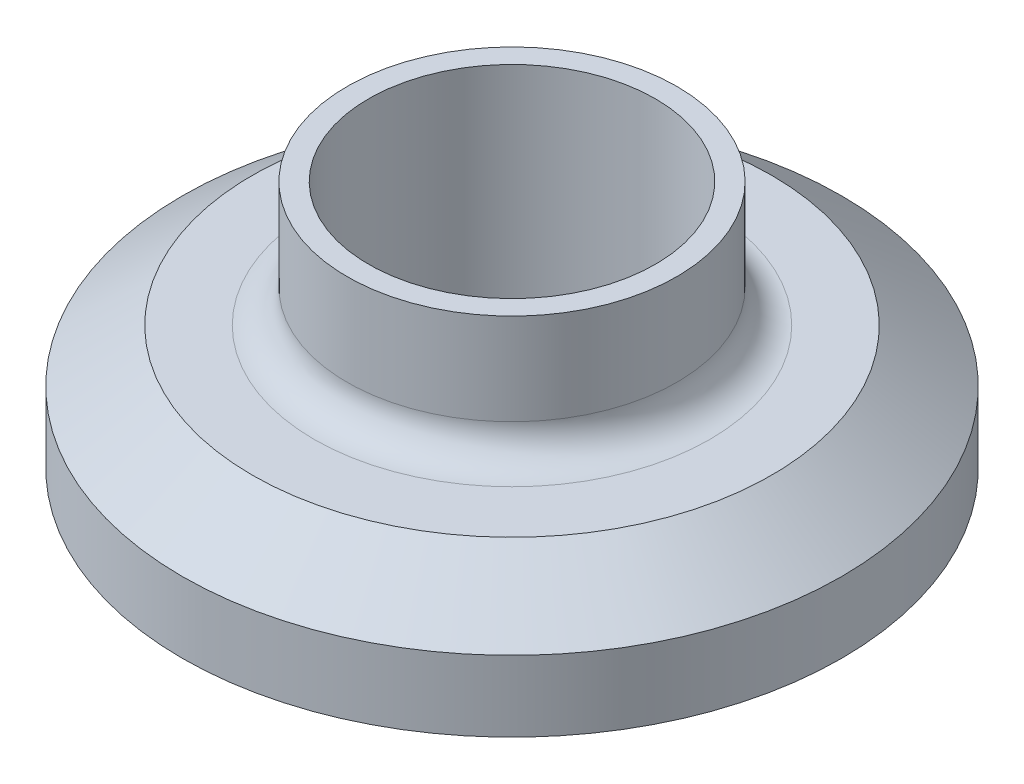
SolidWorks part; units mm, degrees
ref_plane "Front Plane" through (0, 0, 0) normal (0, 0, 1) x (1, 0, 0)
ref_plane "Top Plane" through (0, 0, 0) normal (0, 1, 0) x (1, 0, 0)
ref_plane "Right Plane" through (0, 0, 0) normal (1, 0, 0) x (0, 0, -1)
sketch "Sketch1" plane through (0, 0, 0) normal (0, 0, 1) x (1, 0, 0)
  line L0 (-19.6128, 0) -> (-25.4, 0)
  line L1 (-25.4, 0) -> (-25.4, 5.461)
  line L2 (-25.4, 5.461) -> (-20.0069, 9.525)
  line L3 (-12.7, 12.2874) -> (-12.7, 19.1139)
  line L4 (-12.7, 19.1139) -> (-11.049, 19.1139)
  line L5 (-11.049, 19.1139) -> (-11.049, 0)
  line L6 (-11.049, 0) -> (-16.5568, 0)
  line L7 (-12.7, 12.2874) -> (-12.7, 12.065)
  line L8 (-15.24, 9.525) -> (-20.0069, 9.525)
  line L9 (0, 0) -> (0, 37.2164) construction
  arc A0 (-16.5568, 0) -> (-19.6128, 0) centre (-18.0848, -0.381) ccw
  arc A1 (-15.24, 9.525) -> (-12.7, 12.065) centre (-15.24, 12.065) ccw
  dimension "D1" = 3.1496
  dimension "D7" = 9.525
  dimension "D9" = 2.54
  dimension "D2" = 18.0848
  dimension "D3" = 5.461
  dimension "D4" = 12.7
  dimension "D5" = 11.049
  dimension "D6" = 25.4
  dimension "D8" = 37
  dimension "D10" = 0.381
revolve "Revolve1" add sketch "Sketch1" angle 360 about L9
